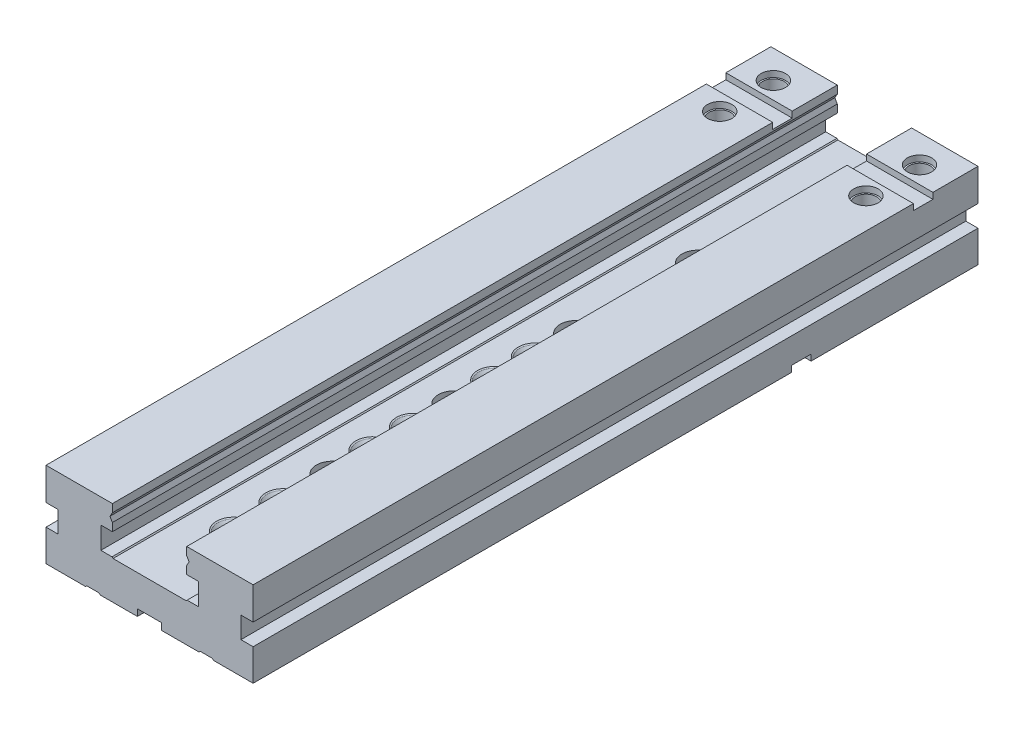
SolidWorks part; units mm, degrees
ref_plane "Front Plane" through (0, 0, 0) normal (0, 0, 1) x (1, 0, 0)
ref_plane "Top Plane" through (0, 0, 0) normal (0, 1, 0) x (1, 0, 0)
ref_plane "Right Plane" through (0, 0, 0) normal (1, 0, 0) x (0, 0, -1)
imported_body "Imported1"
sketch "Sketch1" plane through (0, -3.8, 0) normal (0, 1, 0) x (1, 0, 0)
  circle A0 centre (0, 150) radius 13.2462
  circle A1 centre (0, 250) radius 13.4928
  circle A2 centre (0, 350) radius 13.9596
  circle A3 centre (0, 450) radius 13
extrude "Boss-Extrude1" add sketch "Sketch1" against normal up to surface (25.7 mm away)
hole_wizard "Hole1" positions "Sketch3" profile "Sketch2" legacy
sketch "Sketch3" plane through (0, -3.8, 0) normal (0, 1, 0) x (1, 0, 0)
  line L0 (-30, 595) -> (30, 595) construction
  point P0 (0, 450)
  point P5 (0, 250)
  dimension "D1" = 145
  dimension "D2" = 200
sketch "Sketch2" plane through (0, -3.8, -450) normal (1, 0, 0) x (0, 0, 1)
  line L0 (0, 0) -> (0, 100)
  line L1 (0, 100) -> (8.5, 100)
  line L2 (8.5, 100) -> (8.5, 17)
  line L3 (8.5, 17) -> (13, 17)
  line L4 (13, 17) -> (13, 0)
  line L5 (13, 0) -> (0, 0)
  line L6 (0, 110) -> (0, -10) construction
  dimension "Diameter" = 17
  dimension "Depth" = 100
  dimension "C-Bore Diameter" = 26
  dimension "C-Bore Depth" = 17
hole_wizard "Hole2" positions "Sketch5" profile "Sketch4" legacy
sketch "Sketch5" plane through (0, -3.8, 0) normal (0, 1, 0) x (1, 0, 0)
  circle A0 centre (0, 450) radius 13 construction
  point P0 (0, 350)
  point P2 (0, 150)
  dimension "D1" = 100
  dimension "D2" = 200
sketch "Sketch4" plane through (0, -3.8, -350) normal (1, 0, 0) x (0, 0, 1)
  line L0 (0, 0) -> (0, 100)
  line L1 (0, 100) -> (8, 100)
  line L2 (8, 100) -> (8, 11)
  line L3 (8, 11) -> (13, 11)
  line L4 (13, 11) -> (13, 0)
  line L5 (13, 0) -> (0, 0)
  line L6 (0, 110) -> (0, -10) construction
  dimension "Diameter" = 16
  dimension "Depth" = 100
  dimension "C-Bore Diameter" = 26
  dimension "C-Bore Depth" = 11
